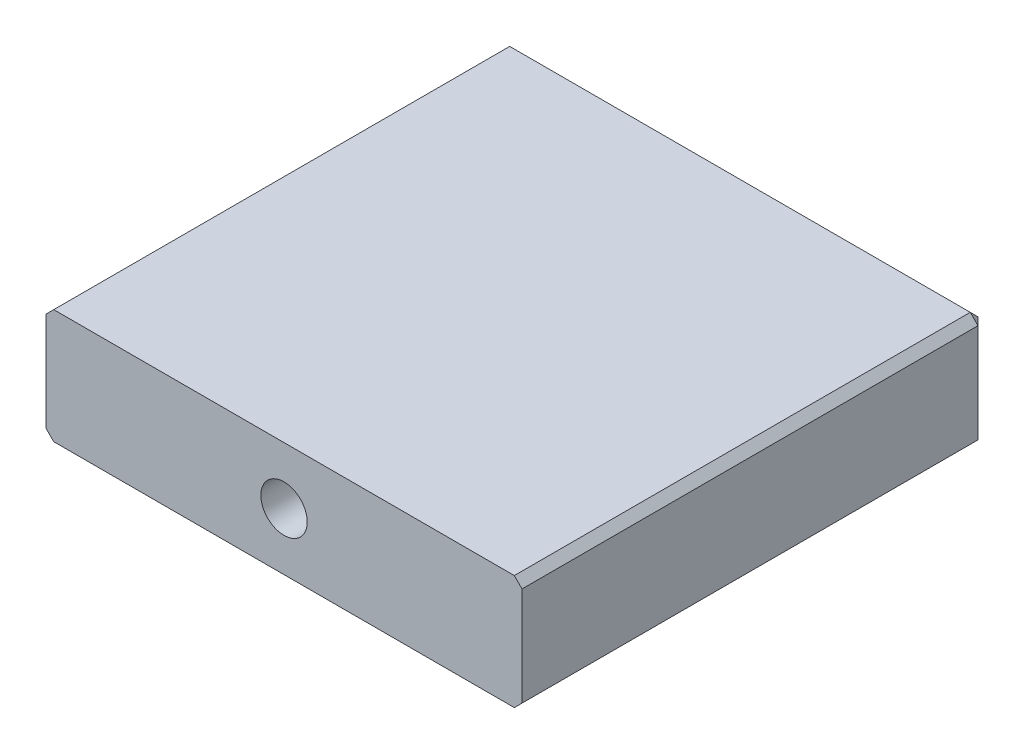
SolidWorks part; units mm, degrees
ref_plane "Plan de face" through (0, 0, 0) normal (0, 0, 1) x (1, 0, 0)
ref_plane "Plan de dessus" through (0, 0, 0) normal (0, 1, 0) x (1, 0, 0)
ref_plane "Plan de droite" through (0, 0, 0) normal (1, 0, 0) x (0, 0, -1)
sketch "Esquisse1" plane through (0, 0, 0) normal (0, 0, 1) x (1, 0, 0)
  line L1 (0, 0) -> (15.4, 0)
  line L2 (0, 0) -> (0, 3.7)
  line L3 (0, 3.7) -> (15.4, 3.7)
  line L4 (15.4, 0) -> (15.4, 3.7)
  circle A0 centre (7.7, 1.85) radius 0.75
  point P9 (15.4, 0.6748)
  dimension "D3" = 1.85
  dimension "D5" = 1.5
  dimension "D1" = 15.4
  dimension "D2" = 3.7
  dimension "D4" = 7.7
extrude "Boss.-Extru.1" add sketch "Esquisse1" along normal blind 15
chamfer "Chanfrein1" distance 0.25 angle 45 8 edges at (0, 0, 7.5) (7.7, 0, 0) (0, 1.85, 0) (0, 3.7, 7.5) (7.7, 3.7, 0) (15.4, 0, 7.5) (15.4, 1.85, 0) (15.4, 3.7, 7.5)
